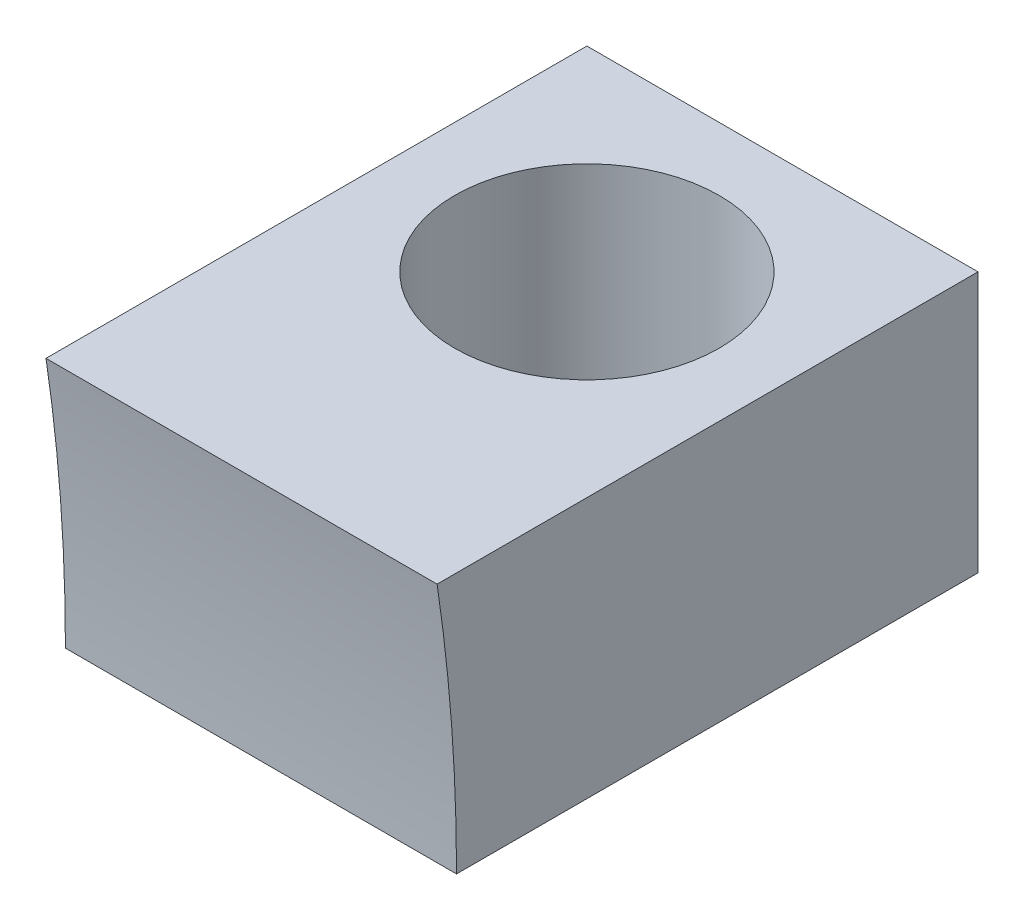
SolidWorks part; units mm, degrees
ref_plane "Front Plane" through (0, 0, 0) normal (0, 0, 1) x (1, 0, 0)
ref_plane "Top Plane" through (0, 0, 0) normal (0, 1, 0) x (1, 0, 0)
ref_plane "Right Plane" through (0, 0, 0) normal (1, 0, 0) x (0, 0, -1)
sketch "Sketch1" plane through (0, 0, 0) normal (1, 0, 0) x (0, 0, -1)
  line L0 (-5.4584, 2.54) -> (5.08, 2.54)
  line L1 (5.08, 2.54) -> (5.08, -2.54)
  line L2 (5.08, -2.54) -> (-5.08, -2.54)
  line L3 (-5.08, -2.54) -> (5.08, 2.54) construction
  arc A0 (-5.08, -2.54) -> (-5.4584, 2.54) centre (-39.37, -2.54) ccw
  dimension "D3" = 34.29
  dimension "D1" = 5.08
  dimension "D2" = 10.16
extrude "Boss-Extrude1" add sketch "Sketch1" along normal mid plane 7.62
sketch "Sketch2" plane through (0, -2.54, 0) normal (0, -1, 0) x (1, 0, 0)
  circle A0 centre (0, -1.27) radius 2.5781
  point P3 (0, -1.1649)
  point P5 (0, 0)
  dimension "D1" = 5.1562
  dimension "D2" = 1.27
extrude "Cut-Extrude1" cut sketch "Sketch2" against normal through all
